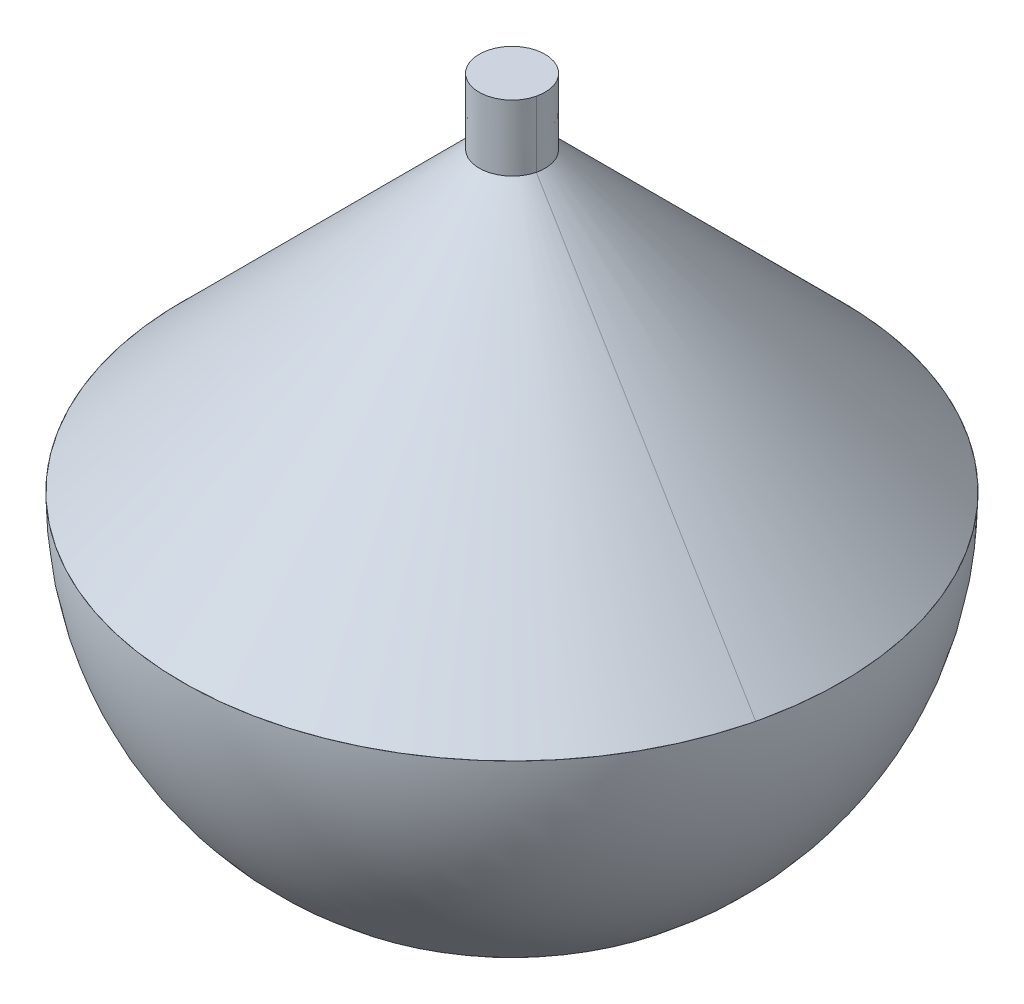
SolidWorks part; units mm, degrees
ref_plane "Alzado" through (0, 0, 0) normal (0, 0, 1) x (1, 0, 0)
ref_plane "Planta" through (0, 0, 0) normal (0, 1, 0) x (1, 0, 0)
ref_plane "Vista lateral" through (0, 0, 0) normal (1, 0, 0) x (0, 0, -1)
imported_body "A1275.IGS<1>"
delete or keep bodies "Sólido-Eliminar/Conservar 1" type delete bodies bodies 104
delete or keep bodies "Sólido-Eliminar/Conservar 2" type delete bodies bodies 102
delete or keep bodies "Sólido-Eliminar/Conservar 3" type delete bodies bodies 103
